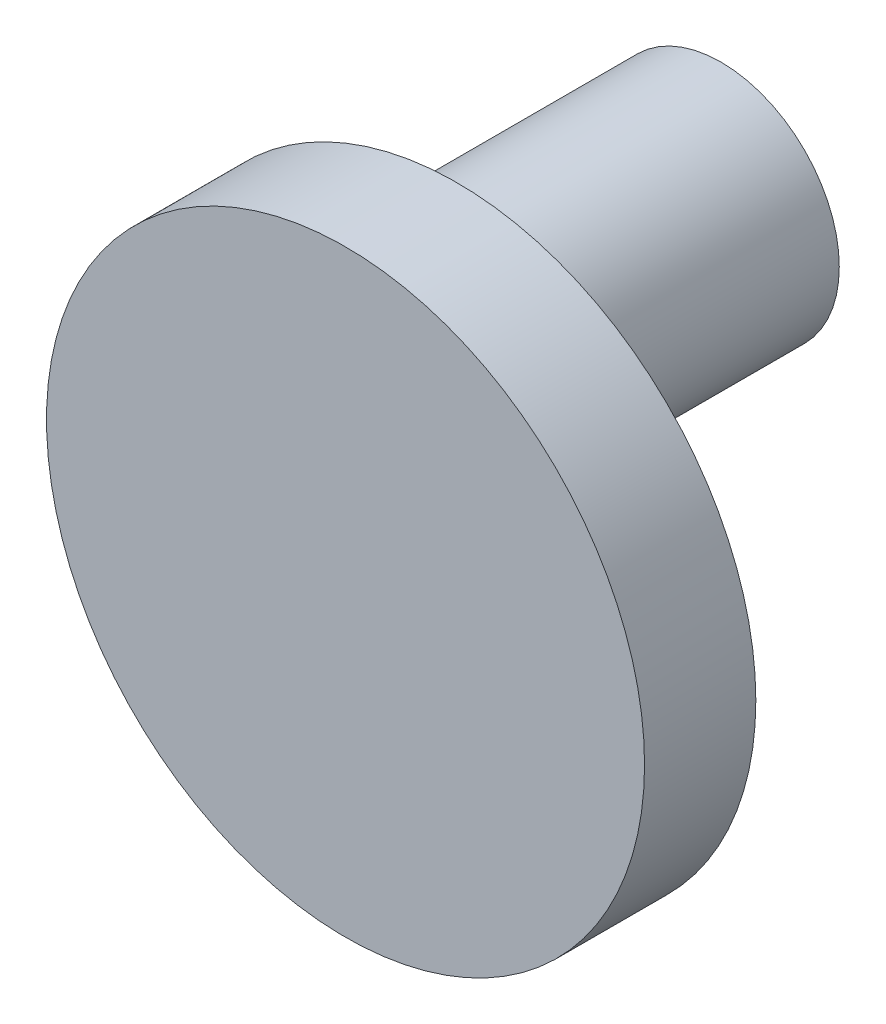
SolidWorks part; units mm, degrees
ref_plane "Plan1" through (0, 0, 0) normal (0, 0, 1) x (1, 0, 0)
ref_plane "Plan2" through (0, 0, 0) normal (0, 1, 0) x (1, 0, 0)
ref_plane "Plan3" through (0, 0, 0) normal (1, 0, 0) x (0, 0, -1)
sketch "Esquisse1" plane through (0, 0, 0) normal (0, 0, 1) x (1, 0, 0)
  circle A0 centre (0, 0) radius 21.5
  dimension "D1" = 43
extrude "Base-Extrusion" add sketch "Esquisse1" against normal blind 8
sketch "Esquisse2" plane through (0, 0, -8) normal (0, 0, -1) x (-1, 0, 0)
  circle A0 centre (11, 0) radius 8.5
  dimension "D1" = 17
  dimension "D2" = 11
extrude "Boss.-Extru.1" add sketch "Esquisse2" along normal blind 30
